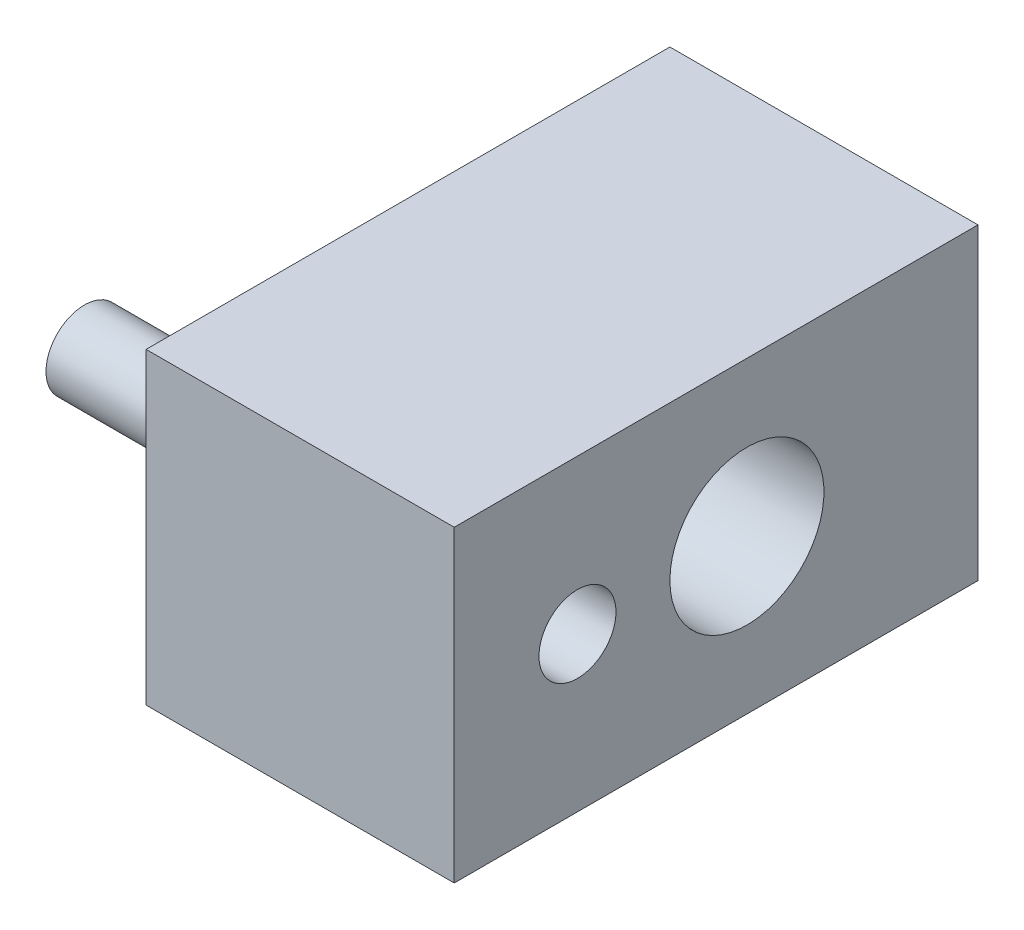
SolidWorks part; units mm, degrees
ref_plane "Plan de face" through (0, 0, 0) normal (0, 0, 1) x (1, 0, 0)
ref_plane "Plan de dessus" through (0, 0, 0) normal (0, 1, 0) x (1, 0, 0)
ref_plane "Plan de droite" through (0, 0, 0) normal (1, 0, 0) x (0, 0, -1)
sketch "Esquisse1" plane through (0, 0, 0) normal (0, 0, 1) x (1, 0, 0)
  line L1 (0, 0) -> (-10, 0)
  line L2 (0, 0) -> (0, 10)
  line L3 (0, 10) -> (-10, 10)
  line L4 (-10, 0) -> (-10, 10)
  dimension "D1" = 10
  dimension "D2" = 10
extrude "Extrusion1" add sketch "Esquisse1" along normal blind 17
sketch "Esquisse2" plane through (0, 0, 0) normal (1, 0, 0) x (0, 0, -1)
  line L0 (0, 5) -> (-7.5, 5)
  line L1 (0, 0) -> (0, 10) construction
  circle A0 centre (-7.5, 5) radius 2.5
  dimension "D2" = 5
  dimension "D1" = 7.5
extrude "Enlèv. mat.-Extru.1" cut sketch "Esquisse2" against normal through all
hole_wizard "Trou taraudé M3x0.51" positions "Esquisse3D1" profile "Esquisse3" tap size "M3x0.5" standard "ISO"
sketch3d "Esquisse3D1"
  line L0 (0, 5, 13) -> (0, 5, 17)
  line L1 (0, 0, 17) -> (0, 10, 17) construction
  circle A0 centre (0, 5, 7.5) radius 2.5 construction
  point P0 (0, 5, 13)
  point P5 (-2.5, 5, 7.5)
  dimension "D1" = 5.5
sketch "Esquisse3" plane through (0, 5, 13) normal (0, 1, 0) x (0, 0, -1)
  line L0 (0, 0) -> (0, 10)
  line L1 (0, 10) -> (1.25, 10)
  line L2 (1.25, 10) -> (1.25, 0)
  line L5 (1.25, 0) -> (0, 0)
  line L11 (0, -6.35) -> (0, 107.95) construction
  dimension "Diamètre du trou pour taraudage jusqu'au prochain" = 2.5
  dimension "Profondeur du trou pour taraudage jusqu'au prochain" = 10
hole_wizard "Trou taraudé M4x0.71" positions "Esquisse3D2" profile "Esquisse4" tap size "M4x0.7" standard "ISO"
sketch3d "Esquisse3D2"
  line L8 (-10, 10, 0) -> (-10, 0, 0) construction
  line L9 (-10, 0, 0) -> (0, 0, 0) construction
  point P22 (-5, 5, 0)
  dimension "D1" = 5
  dimension "D2" = 5
sketch "Esquisse4" plane through (-5, 5, 0) normal (1, 0, 0) x (0, 1, 0)
  line L0 (0, 0) -> (0, 8.9914)
  line L1 (0, 8.9914) -> (1.65, 8)
  line L2 (1.65, 8) -> (1.65, 0)
  line L5 (1.65, 0) -> (0, 0)
  line L10 (0, 8.9914) -> (-1.65, 8) construction
  line L11 (0, -6.35) -> (0, 107.95) construction
  dimension "Diamètre du trou pour taraudage" = 3.3
  dimension "Profondeur du trou pour taraudage" = 8
  dimension "Angle de pointe" = 118
sketch "Esquisse5" plane through (-10, 0, 0) normal (-1, 0, 0) x (0, 0, 1)
  circle A0 centre (13, 5) radius 1.25
  dimension "D1" = 2.5
extrude "Boss.-Extru.1" add sketch "Esquisse5" along normal blind 6 separate body
